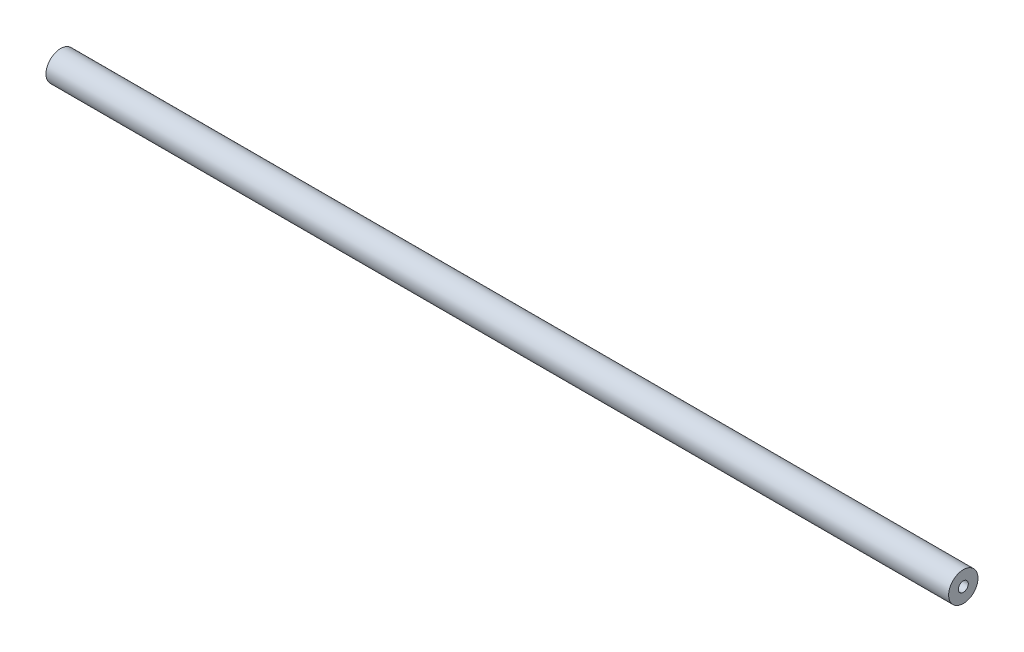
SolidWorks part; units mm, degrees
ref_plane "Plan de face" through (0, 0, 0) normal (0, 0, 1) x (1, 0, 0)
ref_plane "Plan de dessus" through (0, 0, 0) normal (0, 1, 0) x (1, 0, 0)
ref_plane "Plan de droite" through (0, 0, 0) normal (1, 0, 0) x (0, 0, -1)
sketch "Esquisse1" plane through (0, 0, 0) normal (1, 0, 0) x (0, 0, -1)
  circle A0 centre (0, 0) radius 10
  dimension "D1" = 20
extrude "Extrusion1" add sketch "Esquisse1" along normal mid plane 615
hole_wizard "Trou taraudé M8x1.251" positions "Esquisse3" profile "Esquisse2" tap size "M8x1.25" standard "ISO"
sketch "Esquisse3" plane through (307.5, 0, 0) normal (1, 0, 0) x (0, 0, -1)
  circle A0 centre (0, 0) radius 10 construction
  point P0 (0, 0)
sketch "Esquisse2" plane through (307.5, 0, 0) normal (0, 1, 0) x (0, 0, -1)
  line L0 (0, 0) -> (0, 22.0429)
  line L1 (0, 22.0429) -> (3.4, 20)
  line L2 (3.4, 20) -> (3.4, 0)
  line L5 (3.4, 0) -> (0, 0)
  line L10 (0, 22.0429) -> (-3.4, 20) construction
  line L11 (0, -6.35) -> (0, 107.95) construction
  dimension "Diamètre du trou pour taraudage" = 6.8
  dimension "Profondeur du trou pour taraudage" = 20
  dimension "Angle de pointe" = 118
hole_wizard "Trou taraudé M8x1.252" positions "Esquisse5" profile "Esquisse4" tap size "M8x1.25" standard "ISO"
sketch "Esquisse5" plane through (-307.5, 0, 0) normal (-1, 0, 0) x (0, 0, 1)
  circle A0 centre (0, 0) radius 10 construction
  point P0 (0, 0)
sketch "Esquisse4" plane through (-307.5, 0, 0) normal (0, 1, 0) x (0, 0, 1)
  line L0 (0, 0) -> (0, 22.0429)
  line L1 (0, 22.0429) -> (3.4, 20)
  line L2 (3.4, 20) -> (3.4, 0)
  line L5 (3.4, 0) -> (0, 0)
  line L10 (0, 22.0429) -> (-3.4, 20) construction
  line L11 (0, -6.35) -> (0, 107.95) construction
  dimension "Diamètre du trou pour taraudage" = 6.8
  dimension "Profondeur du trou pour taraudage" = 20
  dimension "Angle de pointe" = 118
